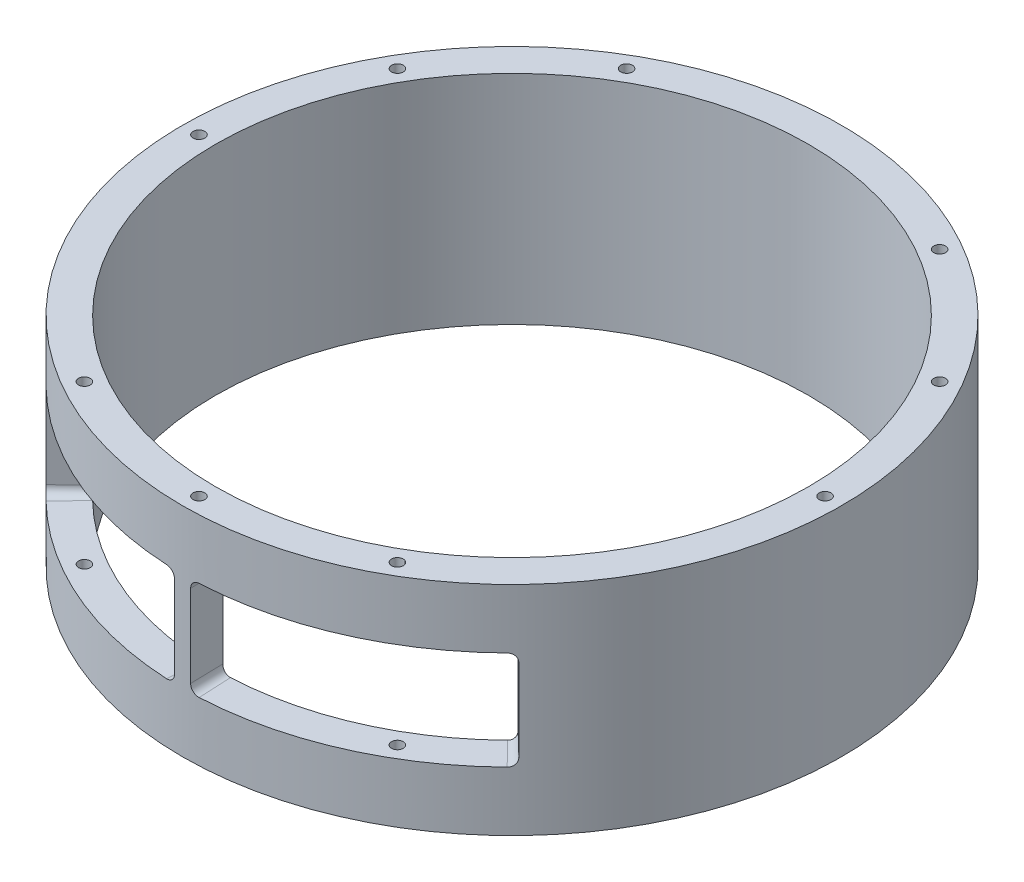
SolidWorks part; units mm, degrees
ref_plane "Front Plane" through (0, 0, 0) normal (0, 0, 1) x (1, 0, 0)
ref_plane "Top Plane" through (0, 0, 0) normal (0, 1, 0) x (1, 0, 0)
ref_plane "Right Plane" through (0, 0, 0) normal (1, 0, 0) x (0, 0, -1)
sketch "Sketch1" plane through (0, 0, 0) normal (0, 1, 0) x (1, 0, 0)
  circle A0 centre (0, 0) radius 57.15
  circle A1 centre (0, 0) radius 63.5
  dimension "D1" = 127
  dimension "D2" = 114.3
extrude "Boss-Extrude1" add sketch "Sketch1" along normal blind 41.91
sketch "Sketch2" plane through (0, 41.91, 0) normal (0, 1, 0) x (1, 0, 0)
  line L0 (0, 0) -> (0, -69.8914) construction
  line L1 (0, 0) -> (-30.1625, -52.243) construction
  line L2 (0, 0) -> (30.1625, -52.243) construction
  circle A1 centre (0, 0) radius 60.325 construction
  circle A2 centre (0, -60.325) radius 1.1303
  circle A3 centre (-30.1625, -52.243) radius 1.1303
  circle A4 centre (30.1625, -52.243) radius 1.1303
  circle A5 centre (-30.1625, 52.243) radius 1.1303
  circle A6 centre (-52.243, 30.1625) radius 1.1303
  circle A7 centre (-60.325, 0) radius 1.1303
  circle A8 centre (60.325, 0) radius 1.1303
  circle A9 centre (52.243, 30.1625) radius 1.1303
  circle A10 centre (30.1625, 52.243) radius 1.1303
  point P25 (0, 0)
  dimension "D1" = 120.65
  dimension "D4" = 2.2606
  dimension "D5" = 2.2606
  dimension "D6" = 2.2606
  dimension "D2" = 30
  dimension "D3" = 30
  dimension "D7" = 3
extrude "Cut-Extrude1" cut sketch "Sketch2" against normal through all
sketch "Sketch3" plane through (0, 0, 0) normal (0, 0, 1) x (1, 0, 0)
  line L0 (0, 0) -> (0, 41.91) construction
  line L2 (63.5, 41.91) -> (-63.5, 41.91) construction
  line L3 (63.5, 20.955) -> (-63.5, 20.955) construction
  line L6 (63.5, 0) -> (63.5, 41.91) construction
  line L7 (-63.5, 41.91) -> (-63.5, 0) construction
  line L8 (49.2125, 11.43) -> (3.1369, 11.43)
  line L9 (1.5494, 13.0175) -> (1.5494, 28.8925)
  line L10 (3.1369, 30.48) -> (49.2125, 30.48)
  line L11 (50.8, 28.8925) -> (50.8, 13.0175)
  line L12 (-50.8, 28.8925) -> (-50.8, 13.0175)
  line L13 (-3.1369, 30.48) -> (-49.2125, 30.48)
  line L14 (-1.5494, 13.0175) -> (-1.5494, 28.8925)
  line L15 (-49.2125, 11.43) -> (-3.1369, 11.43)
  arc A2 (1.5494, 28.8925) -> (3.1369, 30.48) centre (3.1369, 28.8925) cw
  arc A3 (1.5494, 13.0175) -> (3.1369, 11.43) centre (3.1369, 13.0175) ccw
  arc A4 (49.2125, 30.48) -> (50.8, 28.8925) centre (49.2125, 28.8925) cw
  arc A5 (50.8, 13.0175) -> (49.2125, 11.43) centre (49.2125, 13.0175) cw
  arc A6 (-50.8, 13.0175) -> (-49.2125, 11.43) centre (-49.2125, 13.0175) ccw
  arc A7 (-49.2125, 30.48) -> (-50.8, 28.8925) centre (-49.2125, 28.8925) ccw
  arc A8 (-1.5494, 13.0175) -> (-3.1369, 11.43) centre (-3.1369, 13.0175) cw
  arc A9 (-1.5494, 28.8925) -> (-3.1369, 30.48) centre (-3.1369, 28.8925) ccw
  dimension "D5" = 1.5875
  dimension "D1" = 50.8
  dimension "D2" = 1.5494
  dimension "D3" = 19.05
  dimension "D4" = 9.525
wrap "Wrap1" sketch "Sketch3" wrap type deboss source sketch "Sketch3" thickness 8.89 parameters "D1"=8.89
